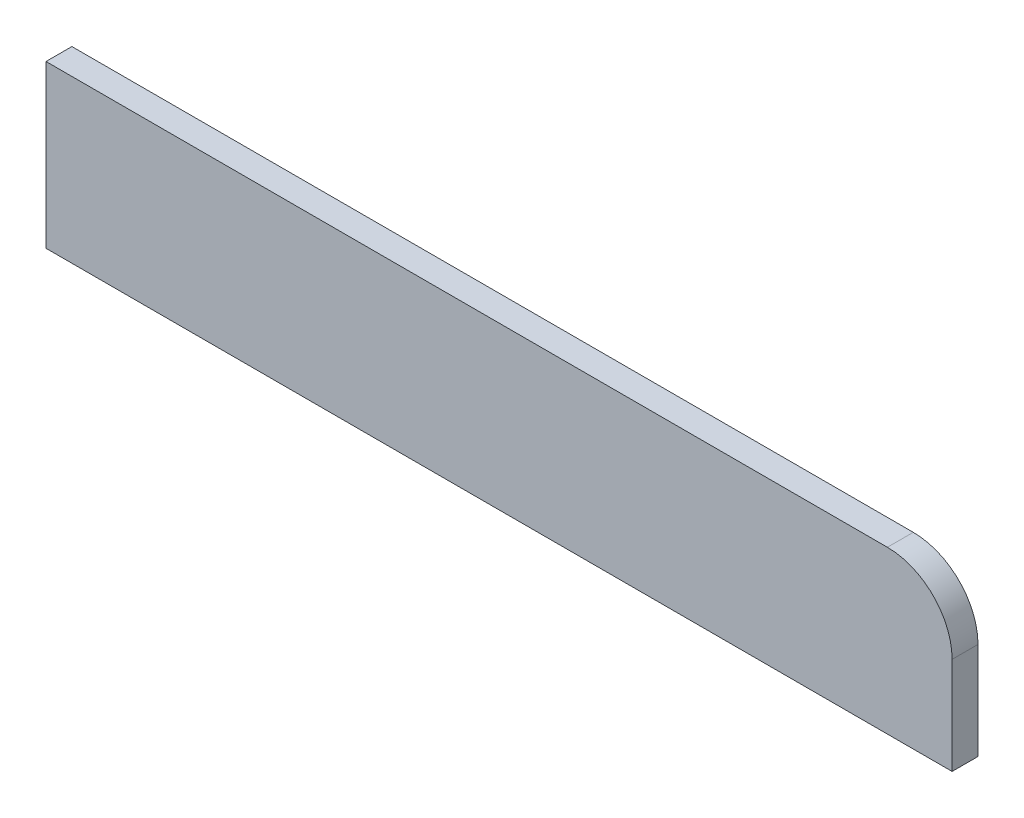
SolidWorks part; units mm, degrees
ref_plane "Face" through (0, 0, 0) normal (0, 0, 1) x (1, 0, 0)
ref_plane "Dessus" through (0, 0, 0) normal (0, 1, 0) x (1, 0, 0)
ref_plane "Droite" through (0, 0, 0) normal (1, 0, 0) x (0, 0, -1)
sketch "Esquisse1" plane through (0, 0, 0) normal (0, 0, 1) x (1, 0, 0)
  line L0 (0, 0) -> (0, -50)
  line L1 (0, 0) -> (260, 0)
  line L2 (0, -50) -> (280, -50)
  line L3 (280, -50) -> (280, -20)
  arc A0 (280, -20) -> (260, 0) centre (260, -20) ccw
  point P7 (280, 0)
  dimension "D3" = 20
  dimension "D1" = 280
  dimension "D2" = 50
extrude "Base-Extrusion" add sketch "Esquisse1" along normal blind 8
